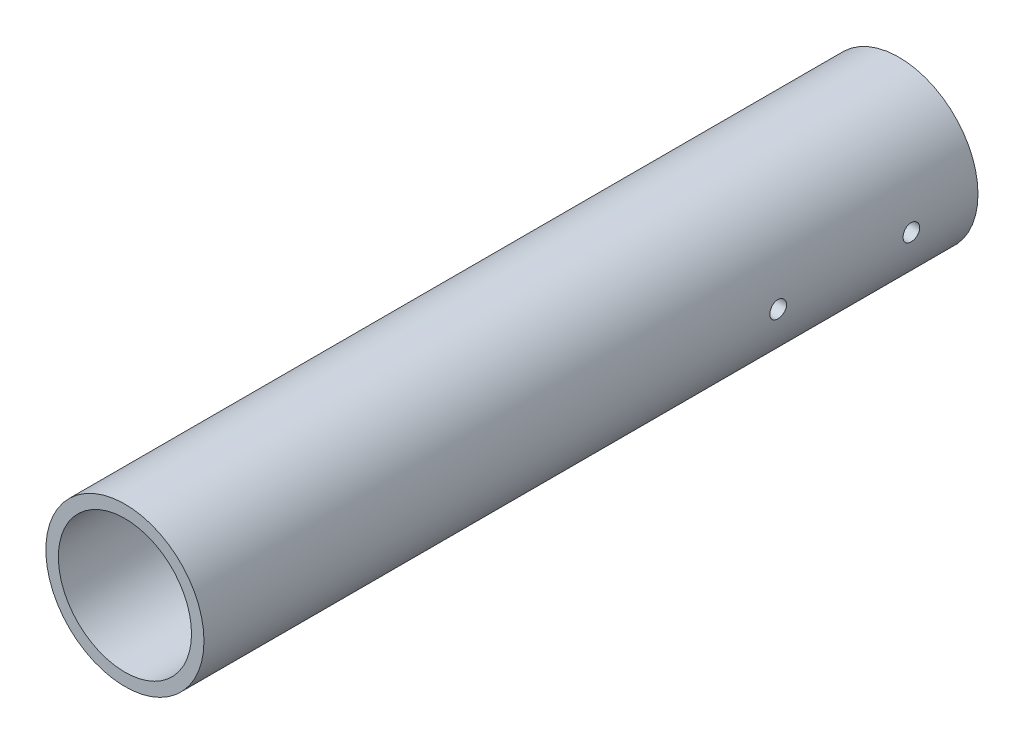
SolidWorks part; units mm, degrees
ref_plane "Front Plane" through (0, 0, 0) normal (0, 0, 1) x (1, 0, 0)
ref_plane "Top Plane" through (0, 0, 0) normal (0, 1, 0) x (1, 0, 0)
ref_plane "Right Plane" through (0, 0, 0) normal (1, 0, 0) x (0, 0, -1)
sketch "Sketch1" plane through (0, 0, 0) normal (0, 0, 1) x (1, 0, 0)
  circle A0 centre (0, 0) radius 30.1625
  circle A1 centre (0, 0) radius 25.4
  dimension "D1" = 60.325
  dimension "D2" = 50.8
extrude "Boss-Extrude1" add sketch "Sketch1" along normal blind 295.275
sketch "Sketch2" plane through (0, 0, 0) normal (1, 0, 0) x (0, 0, -1)
  line L0 (-295.275, 0) -> (0, 0) construction
  line L1 (-295.275, 30.1625) -> (-295.275, -30.1625) construction
  line L2 (0, -30.1625) -> (0, 30.1625) construction
  circle A0 centre (-76.2, 0) radius 3.175
  circle A1 centre (-25.4, 0) radius 3.175
  dimension "D1" = 6.35
  dimension "D2" = 6.35
  dimension "D3" = 50.8
  dimension "D4" = 25.4
extrude "Cut-Extrude1" cut sketch "Sketch2" against normal through all both and the other way through all
sketch "Sketch3" plane through (0, 0, 295.275) normal (0, 0, 1) x (1, 0, 0)
  line L0 (-30.1625, 0) -> (30.1625, 0) construction
  line L1 (0, -30.1625) -> (0, 30.1625) construction
  circle A0 centre (0, 0) radius 30.1625 construction
